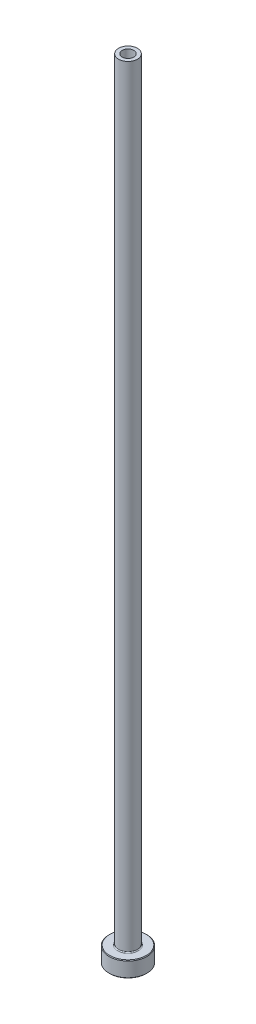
SolidWorks part; units mm, degrees
ref_plane "Front Plane" through (0, 0, 0) normal (0, 0, 1) x (1, 0, 0)
ref_plane "Top Plane" through (0, 0, 0) normal (0, 1, 0) x (1, 0, 0)
ref_plane "Right Plane" through (0, 0, 0) normal (1, 0, 0) x (0, 0, -1)
sketch "Sketch1" plane through (0, 0, 0) normal (0, 0, 1) x (1, 0, 0)
  line L0 (-1.85, 250) -> (-3, 250)
  line L1 (-3, 250) -> (-3, 5)
  line L2 (-3, 5) -> (-6, 5)
  line L3 (-6, 5) -> (-6, 0)
  line L4 (6.6, 0) -> (-6.6, 0) construction
  line L5 (-6, 0) -> (-2.1, 0)
  line L6 (-1.85, 205) -> (-1.85, 250)
  line L7 (0, 92.1877) -> (0, -15.5353) construction
  line L8 (0, -6.6) -> (0, 6.6) construction
  line L9 (-1.85, 205) -> (-2.1, 193)
  line L10 (-2.1, 193) -> (-2.1, 0)
  dimension "D1" = 0.25
  dimension "ID" = 3.7
  dimension "OD" = 6
  dimension "L" = 250
  dimension "H" = 12
  dimension "T" = 5
  dimension "N" = 45
  dimension "D2" = 12
revolve "Revolve1" add sketch "Sketch1" angle 360 about L7
fillet "Fillet1" radius 0.3 1 edges at (0, 5, 3)
chamfer "Chamfer1" distance 0.2 angle 45 2 edges at (0, 5, 6) (0, 0, 6)
chamfer "Chamfer3" distance 0.5 angle 45 1 edges at (0, 0, 2.1)
